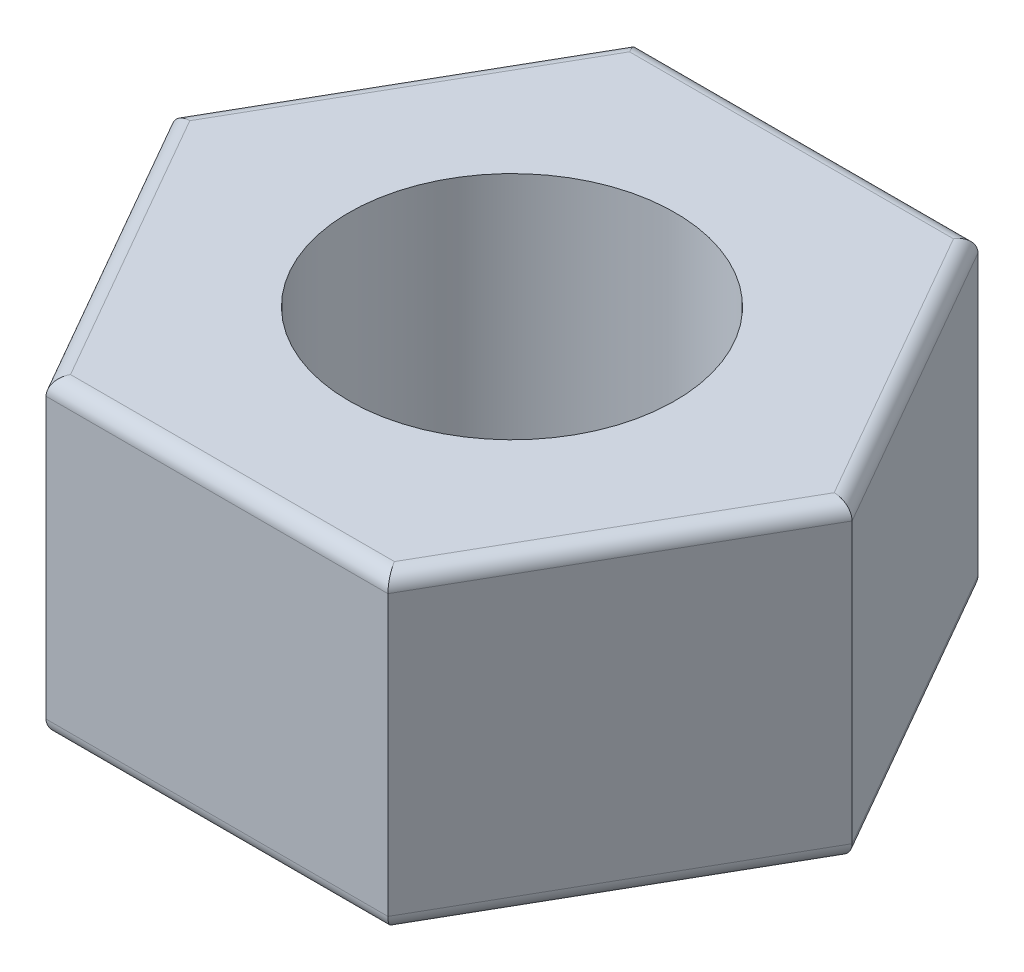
SolidWorks part; units mm, degrees
ref_plane "Plan de face" through (0, 0, 0) normal (0, 0, 1) x (1, 0, 0)
ref_plane "Plan de dessus" through (0, 0, 0) normal (0, 1, 0) x (1, 0, 0)
ref_plane "Plan de droite" through (0, 0, 0) normal (1, 0, 0) x (0, 0, -1)
sketch "Esquisse1" plane through (0, 0, 0) normal (0, 1, 0) x (1, 0, 0)
  line L0 (-10.95, 0) -> (10.95, 0) construction
  line L1 (0, -9.5) -> (0, 9.5) construction
  line L2 (-5.5046, 9.5) -> (5.5046, 9.5)
  line L3 (5.5046, 9.5) -> (10.95, 0)
  line L4 (-5.5046, 9.5) -> (-10.95, 0)
  line L5 (-5.5046, -9.5) -> (-10.95, 0)
  line L6 (5.5046, -9.5) -> (10.95, 0)
  line L7 (-5.5046, -9.5) -> (5.5046, -9.5)
  circle A0 centre (0, 0) radius 5.25
  point P8 (0, 0)
  dimension "D4" = 10.5
  dimension "D1" = 19
  dimension "D2" = 19
  dimension "D3" = 21.9
extrude "Extrusion1" add sketch "Esquisse1" along normal blind 10
fillet "Congé1" radius 0.5 12 edges at (0, 10, 9.5) (-8.2273, 0, 4.75) (-8.2273, 0, -4.75) (0, 0, -9.5) (8.2273, 0, -4.75) (8.2273, 0, 4.75) (0, 0, 9.5) (-8.2273, 10, 4.75) (-8.2273, 10, -4.75) (0, 10, -9.5) (8.2273, 10, -4.75) (8.2273, 10, 4.75)
